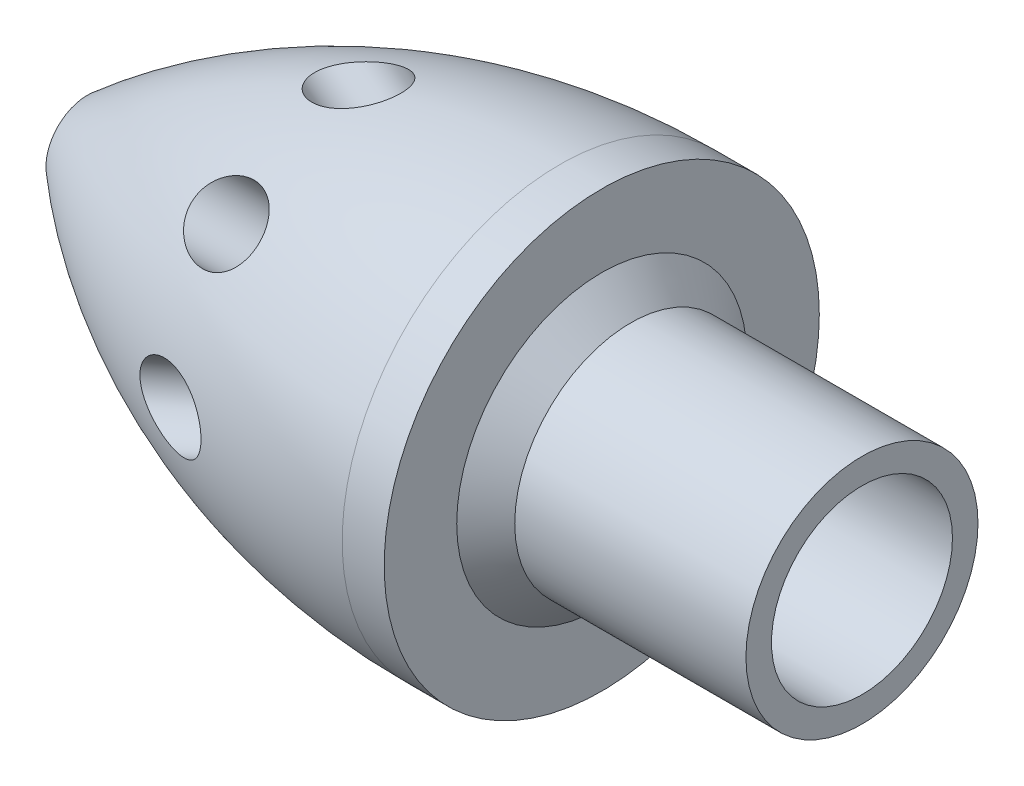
SolidWorks part; units mm, degrees
ref_plane "Front" through (0, 0, 0) normal (0, 0, 1) x (1, 0, 0)
ref_plane "Top" through (0, 0, 0) normal (0, 1, 0) x (1, 0, 0)
ref_plane "Right" through (0, 0, 0) normal (1, 0, 0) x (0, 0, -1)
sketch "Sketch1" plane through (0, 0, 0) normal (0, 0, 1) x (1, 0, 0)
  line L0 (0, 0) -> (-49.8238, 0) construction
  line L1 (0, 19.05) -> (-3.6801, 19.05)
  line L2 (0, 19.05) -> (0, -19.05) construction
  line L3 (-45.039, 3.6291) -> (-45.039, 1.9239)
  line L4 (0, 12.7) -> (0, 19.05)
  line L5 (-14.1691, 7.9244) -> (-45.039, 1.9239)
  line L6 (0, 12.7) -> (2.54, 10.16)
  line L7 (2.54, 10.16) -> (22.7838, 10.16)
  line L8 (22.7838, 10.16) -> (22.7838, 7.9244)
  line L10 (22.7838, 7.9244) -> (-14.1691, 7.9244)
  arc A0 (-3.6801, 19.05) -> (-45.039, 3.6291) centre (-3.6801, -44.1226) ccw
  dimension "D1" = 63.1726
  dimension "D2" = 30.8698
  dimension "D3" = 41.3588
  dimension "D4" = 22.7838
  dimension "D5" = 6.35
  dimension "D6" = 8.89
  dimension "D7" = 11.1256
  dimension "D8" = 11
  dimension "D9" = 67.8228
  dimension "D10" = 36.9529
  dimension "D11" = 7.2582
revolve "Revolve1" add sketch "Sketch1" angle 360 about L0
sketch "Hole Center" plane through (0, 0, 0) normal (0, 0, 1) x (1, 0, 0)
  line L0 (0, 0) -> (-30.5863, 23.4697) construction
  line L1 (0, 0) -> (-45.039, 0) construction
  line L2 (-45.039, 3.6291) -> (-45.039, -3.6291) construction
  dimension "D1" = 37.5
ref_plane "Plane1" through (-30.5863, 23.4697, 0) normal (-0.7934, 0.6088, 0) x (0, 0, 1)
sketch "Sketch3" plane through (-30.5863, 23.4697, 0) normal (-0.7934, 0.6088, 0) x (0, 0, 1)
  circle A0 centre (0, 0) radius 3.175
  dimension "D1" = 6.35
extrude "Cut-Extrude1" cut sketch "Sketch3" against normal blind 31.75
pattern_circular "CirPattern1" count 8 over 360 about axis through (0, 0, 0) along (-1, 0, 0) of "Cut-Extrude1"
